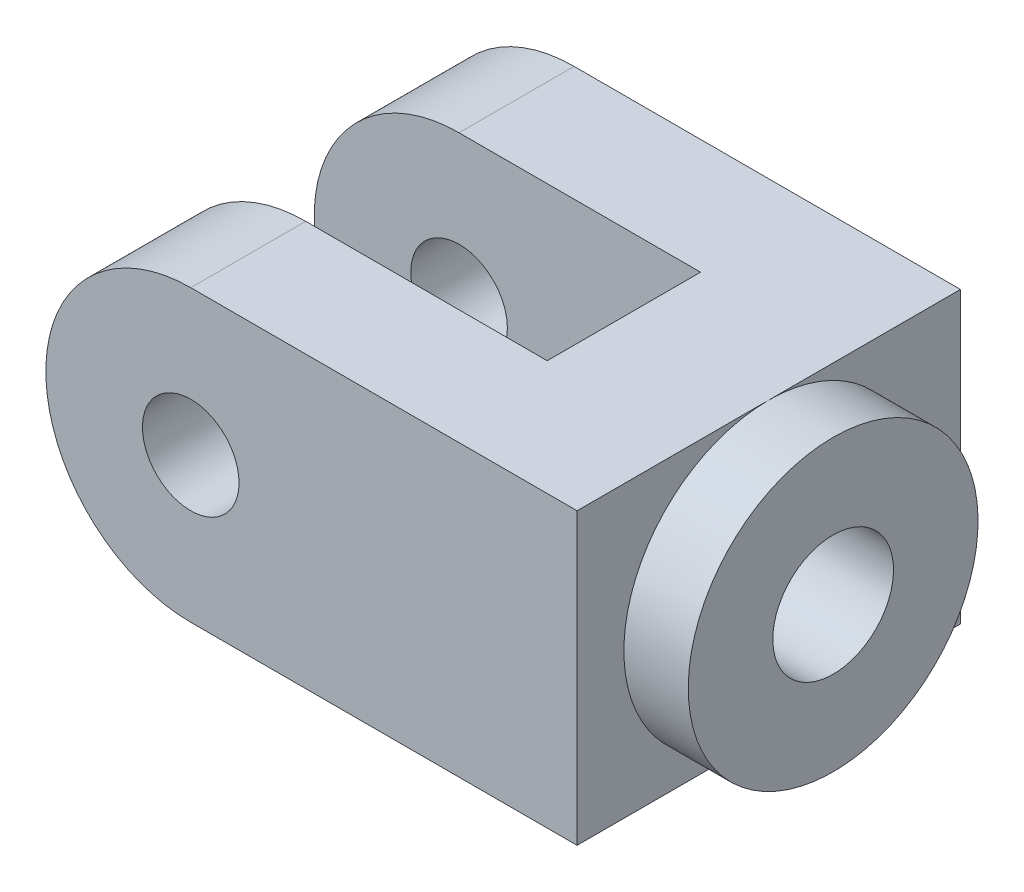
SolidWorks part; units mm, degrees
ref_plane "Front Plane" through (0, 0, 0) normal (0, 0, 1) x (1, 0, 0)
ref_plane "Top Plane" through (0, 0, 0) normal (0, 1, 0) x (1, 0, 0)
ref_plane "Right Plane" through (0, 0, 0) normal (1, 0, 0) x (0, 0, -1)
sketch "Sketch1" plane through (0, 0, 0) normal (0, 0, 1) x (1, 0, 0)
  line L1 (-66, 36) -> (66, 36)
  line L2 (-66, 36) -> (-66, -36)
  line L3 (-66, -36) -> (66, -36)
  line L4 (66, 36) -> (66, -36)
  line L5 (-66, 36) -> (66, -36) construction
  line L6 (-66, -36) -> (66, 36) construction
  point P0 (0, 0)
  dimension "D1" = 132
  dimension "D2" = 72
extrude "Boss-Extrude1" add sketch "Sketch1" along normal mid plane 95.25
sketch "Sketch2" plane through (0, 0, 47.625) normal (0, 0, 1) x (1, 0, 0)
  line L0 (66, 36) -> (-66, 36) construction
  line L1 (-66, -36) -> (66, -36) construction
  line L2 (-66, 36) -> (-66, -36) construction
  arc A0 (-30, 36) -> (-30, -36) centre (-30, 0) ccw
  dimension "D1" = 36
extrude "Cut-Extrude1" cut sketch "Sketch2" against normal through all and the other way through all flip side to cut
sketch "Sketch3" plane through (0, 36, 0) normal (0, 1, 0) x (1, 0, 0)
  line L0 (-66, 47.625) -> (-66, -47.625) construction
  line L1 (30, 19.05) -> (-66, 19.05)
  line L2 (30, 19.05) -> (30, -19.05)
  line L3 (30, -19.05) -> (-66, -19.05)
  line L4 (-66, 19.05) -> (-66, -19.05)
  line L5 (66, -47.625) -> (-30, -47.625) construction
  line L6 (-30, -47.625) -> (-30, 47.625) construction
  dimension "D1" = 38.1
  dimension "D2" = 28.575
  dimension "D3" = 60
extrude "Cut-Extrude2" cut sketch "Sketch3" against normal through all
sketch "Sketch4" plane through (66, 0, 0) normal (1, 0, 0) x (0, 0, -1)
  circle A0 centre (0, 0) radius 15
  dimension "D1" = 30
extrude "Cut-Extrude3" cut sketch "Sketch4" against normal through all
sketch "Sketch5" plane through (66, 0, 0) normal (1, 0, 0) x (0, 0, -1)
  circle A0 centre (0, 0) radius 36
  circle A1 centre (0, 0) radius 15 construction
  circle A2 centre (0, 0) radius 15
  dimension "D1" = 72
extrude "Boss-Extrude2" add sketch "Sketch5" along normal blind 16
sketch "Sketch6" plane through (0, 0, 47.625) normal (0, 0, 1) x (1, 0, 0)
  circle A0 centre (-30, 0) radius 12
  arc A1 (-30, 36) -> (-30, -36) centre (-30, 0) ccw construction
  dimension "D1" = 24
extrude "Cut-Extrude4" cut sketch "Sketch6" against normal through all
